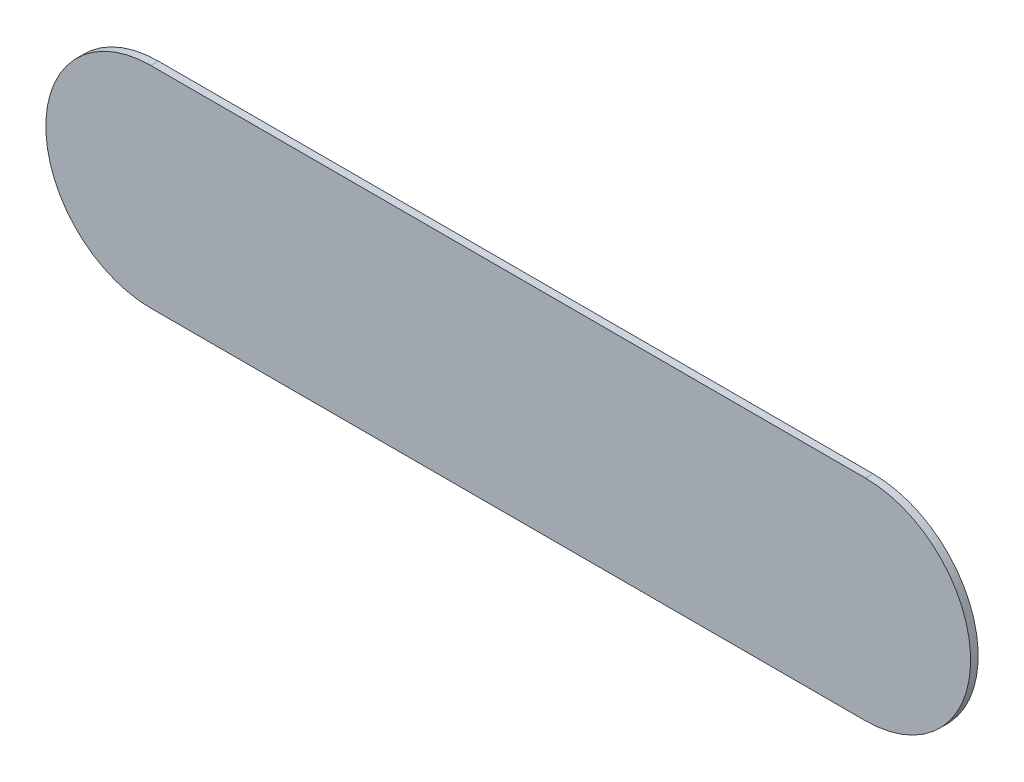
SolidWorks part; units mm, degrees
ref_plane "Plan de face" through (0, 0, 0) normal (0, 0, 1) x (1, 0, 0)
ref_plane "Plan de dessus" through (0, 0, 0) normal (0, 1, 0) x (1, 0, 0)
ref_plane "Plan de droite" through (0, 0, 0) normal (1, 0, 0) x (0, 0, -1)
sketch "Esquisse1" plane through (0, 0, 0) normal (0, 0, 1) x (1, 0, 0)
  line L1 (-850, -250) -> (850, -250)
  line L3 (-850, 250) -> (850, 250)
  arc A0 (-850, 250) -> (-850, -250) centre (-850, 0) ccw
  arc A1 (850, -250) -> (850, 250) centre (850, 0) ccw
  point P0 (0, 0)
  dimension "D3" = 500
  dimension "D5" = 500
extrude "Boss.-Extru.1" add sketch "Esquisse1" along normal blind 18
